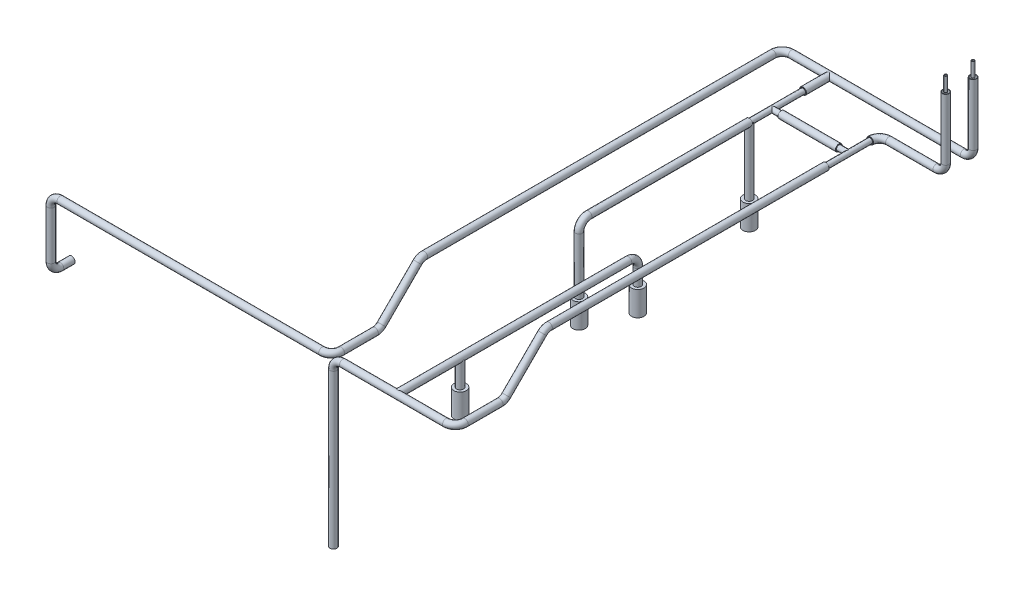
SolidWorks part; units mm, degrees
ref_plane "Alzado" through (0, 0, 0) normal (0, 0, 1) x (1, 0, 0)
ref_plane "Planta" through (0, 0, 0) normal (0, 1, 0) x (1, 0, 0)
ref_plane "Vista lateral" through (0, 0, 0) normal (1, 0, 0) x (0, 0, -1)
sketch3d "Croquis3D1"
  line L0 (-93.1567, 1334.4966, 5736.2426) -> (-93.1567, 1334.4966, 5856.2426)
  line L1 (-93.1567, 1434.4966, 5956.2426) -> (-93.1567, 1944.4966, 5956.2426)
  line L2 (6.8433, 2044.4966, 5956.2426) -> (2776.8433, 2044.4966, 5956.2426)
  line L3 (3566.8433, 2044.4966, 5956.2426) -> (3566.8433, 2044.4966, 5286.2426)
  line L4 (3566.8433, 2044.4966, 5286.2426) -> (3566.8433, 1774.4966, 5286.2426)
  line L5 (2876.8433, 2044.4966, 5856.2426) -> (2876.8433, 2044.4966, 5497.664)
  line L6 (2876.8433, 2073.7859, 5426.9533) -> (2876.8433, 2453.6135, 5047.1257)
  line L7 (2876.8433, 2482.9028, 4976.4151) -> (2876.8433, 2482.9028, 1287.8364)
  line L9 (3566.8433, 2044.4966, 5286.2426) -> (3566.8433, 2044.4966, 3506.2426)
  line L10 (3566.8433, 1944.4966, 3406.2426) -> (3566.8433, 1774.4966, 3406.2426)
  line L11 (2976.8433, 2482.9028, 1187.8364) -> (3376.8433, 2482.9028, 1187.8364)
  line L12 (3376.8433, 2482.9028, 1187.8364) -> (3376.8433, 2482.9028, 1797.8364)
  line L13 (3376.8433, 2482.9028, 1187.8364) -> (4796.8433, 2482.9028, 1187.8364)
  line L14 (4896.8433, 2582.9028, 1187.8364) -> (4896.8433, 3232.9028, 1187.8364)
  line L15 (3376.8433, 2482.9028, 1797.8364) -> (4186.8433, 2482.9028, 1797.8364)
  line L16 (4186.8433, 2482.9028, 1797.8364) -> (4186.8433, 2482.9028, 1567.8364)
  line L17 (4286.8433, 2482.9028, 1467.8364) -> (4786.8433, 2482.9028, 1467.8364)
  line L18 (4886.8433, 2582.9028, 1467.8364) -> (4886.8433, 3232.9028, 1467.8364)
  line L19 (4186.8433, 2482.9028, 1797.8364) -> (4186.8433, 2482.9028, 2037.8364)
  line L20 (4186.8433, 2482.9028, 2037.8364) -> (4186.8433, 2482.9028, 4966.4151)
  line L21 (4186.8433, 2453.6135, 5037.1257) -> (4186.8433, 2073.7859, 5416.9533)
  line L22 (4186.8433, 2044.4966, 5487.664) -> (4186.8433, 2044.4966, 5856.2426)
  line L23 (4086.8433, 2044.4966, 5956.2426) -> (3566.8433, 2044.4966, 5956.2426)
  line L24 (3376.8433, 2482.9028, 1797.8364) -> (3376.8433, 2482.9028, 2037.8364)
  line L25 (3376.8433, 2482.9028, 2037.8364) -> (3376.8433, 2482.9028, 3737.8364)
  line L26 (3376.8433, 2382.9028, 3837.8364) -> (3376.8433, 1782.9028, 3837.8364)
  line L27 (3376.8433, 2482.9028, 2037.8364) -> (3376.8433, 1782.9028, 2037.8364)
  line L28 (3566.8433, 1774.4966, 5286.2426) -> (3566.8433, 1514.4966, 5286.2426)
  line L29 (3566.8433, 1774.4966, 3406.2426) -> (3566.8433, 1514.4966, 3406.2426)
  line L30 (3376.8433, 1782.9028, 3837.8364) -> (3376.8433, 1522.9028, 3837.8364)
  line L31 (3376.8433, 1782.9028, 2037.8364) -> (3376.8433, 1522.9028, 2037.8364)
  line L32 (4886.8433, 3232.9028, 1467.8364) -> (4886.8433, 3382.9028, 1467.8364)
  line L33 (4896.8433, 3232.9028, 1187.8364) -> (4896.8433, 3382.9028, 1187.8364)
  line L34 (3566.8433, 2044.4966, 5956.2426) -> (2996.8433, 2044.4966, 5956.2426)
  line L35 (2896.8433, 1944.4966, 5956.2426) -> (2896.8433, 314.4966, 5956.2426)
  line L36 (3376.8433, 2482.9028, 3737.8364) -> (3376.8433, 2482.9028, 2037.8364) construction
  arc A0 (3376.8433, 2482.9028, 3737.8364) -> (3376.8433, 2382.9028, 3837.8364) centre (3376.8433, 2382.9028, 3737.8364) ccw
  arc A1 (4186.8433, 2482.9028, 4966.4151) -> (4186.8433, 2453.6135, 5037.1257) centre (4186.8433, 2382.9028, 4966.4151) ccw
  arc A2 (4186.8433, 2482.9028, 1567.8364) -> (4286.8433, 2482.9028, 1467.8364) centre (4286.8433, 2482.9028, 1567.8364) ccw
  arc A3 (4786.8433, 2482.9028, 1467.8364) -> (4886.8433, 2582.9028, 1467.8364) centre (4786.8433, 2582.9028, 1467.8364) ccw
  arc A4 (4796.8433, 2482.9028, 1187.8364) -> (4896.8433, 2582.9028, 1187.8364) centre (4796.8433, 2582.9028, 1187.8364) ccw
  arc A5 (2876.8433, 2482.9028, 1287.8364) -> (2976.8433, 2482.9028, 1187.8364) centre (2976.8433, 2482.9028, 1287.8364) ccw
  arc A6 (2876.8433, 2453.6135, 5047.1257) -> (2876.8433, 2482.9028, 4976.4151) centre (2876.8433, 2382.9028, 4976.4151) ccw
  arc A7 (2876.8433, 2044.4966, 5497.664) -> (2876.8433, 2073.7859, 5426.9533) centre (2876.8433, 2144.4966, 5497.664) ccw
  arc A8 (4186.8433, 2073.7859, 5416.9533) -> (4186.8433, 2044.4966, 5487.664) centre (4186.8433, 2144.4966, 5487.664) ccw
  arc A9 (4186.8433, 2044.4966, 5856.2426) -> (4086.8433, 2044.4966, 5956.2426) centre (4086.8433, 2044.4966, 5856.2426) ccw
  arc A10 (-93.1567, 1944.4966, 5956.2426) -> (6.8433, 2044.4966, 5956.2426) centre (6.8433, 1944.4966, 5956.2426) ccw
  arc A11 (-93.1567, 1334.4966, 5856.2426) -> (-93.1567, 1434.4966, 5956.2426) centre (-93.1567, 1434.4966, 5856.2426) ccw
  arc A12 (3566.8433, 2044.4966, 3506.2426) -> (3566.8433, 1944.4966, 3406.2426) centre (3566.8433, 1944.4966, 3506.2426) ccw
  arc A13 (2876.8433, 2044.4966, 5856.2426) -> (2776.8433, 2044.4966, 5956.2426) centre (2776.8433, 2044.4966, 5856.2426) ccw
  arc A14 (2896.8433, 1944.4966, 5956.2426) -> (2996.8433, 2044.4966, 5956.2426) centre (2996.8433, 1944.4966, 5956.2426) ccw
  point P34 (4186.8433, 2482.9028, 5007.8364)
  point P35 (4286.8433, 2382.9028, 4966.4151)
  point P38 (4186.8433, 2482.9028, 1467.8364)
  point P39 (4286.8433, 2382.9028, 1567.8364)
  point P42 (4886.8433, 2482.9028, 1467.8364)
  point P43 (4786.8433, 2582.9028, 1567.8364)
  point P46 (4896.8433, 2482.9028, 1187.8364)
  point P47 (4796.8433, 2582.9028, 1287.8364)
  point P50 (2876.8433, 2482.9028, 1187.8364)
  point P51 (2976.8433, 2382.9028, 1287.8364)
  point P54 (2876.8433, 2482.9028, 5017.8364)
  point P55 (2776.8433, 2382.9028, 4976.4151)
  point P58 (2876.8433, 2044.4966, 5456.2426)
  point P59 (2976.8433, 2144.4966, 5497.664)
  point P62 (4186.8433, 2044.4966, 5446.2426)
  point P63 (4086.8433, 2144.4966, 5487.664)
  point P66 (4186.8433, 2044.4966, 5956.2426)
  point P67 (4086.8433, 1944.4966, 5856.2426)
  point P70 (-93.1567, 2044.4966, 5956.2426)
  point P71 (6.8433, 1944.4966, 5856.2426)
  point P74 (-93.1567, 1334.4966, 5956.2426)
  point P75 (-193.1567, 1434.4966, 5856.2426)
  point P81 (3376.8433, 2482.9028, 3837.8364)
  point P82 (3476.8433, 2382.9028, 3737.8364)
  point P85 (3566.8433, 2044.4966, 3406.2426)
  point P86 (3466.8433, 1944.4966, 3506.2426)
  point P89 (2876.8433, 2044.4966, 5956.2426)
  point P91 (2776.8433, 1944.4966, 5856.2426)
  point P96 (2896.8433, 2044.4966, 5956.2426)
  point P97 (2996.8433, 1944.4966, 5856.2426)
  dimension "D31" = 100
  dimension "D38" = 100
  dimension "D11" = 100
  dimension "D41" = 100
  dimension "D1" = 220
  dimension "D2" = 710
  dimension "D3" = 3660
  dimension "D4" = 670
  dimension "D5" = 270
  dimension "D6" = 2970
  dimension "D7" = 500
  dimension "D8" = 45
  dimension "D9" = 620
  dimension "D10" = 3830
  dimension "D39" = 670
  dimension "D12" = 1880
  dimension "D13" = 270
  dimension "D14" = 500
  dimension "D15" = 610
  dimension "D16" = 1520
  dimension "D17" = 750
  dimension "D18" = 810
  dimension "D19" = 330
  dimension "D20" = 700
  dimension "D21" = 750
  dimension "D22" = 240
  dimension "D23" = 2970
  dimension "D24" = 45
  dimension "D25" = 620
  dimension "D26" = 510
  dimension "D27" = 240
  dimension "D28" = 1800
  dimension "D29" = 700
  dimension "D30" = 700
  dimension "D32" = 260
  dimension "D33" = 260
  dimension "D34" = 260
  dimension "D35" = 260
  dimension "D36" = 150
  dimension "D37" = 150
  dimension "D40" = 1730
ref_plane "Plano1" through (-93.1567, 1334.4966, 5736.2426) normal (0, 0, 1) x (1, 0, 0)
sketch "Croquis1" plane through (-93.1567, 1334.4966, 5736.2426) normal (0, 0, 1) x (1, 0, 0)
  circle A0 centre (0, 0) radius 36.5
  circle A1 centre (0, 0) radius 31.75
  dimension "D1" = 63.5
  dimension "D2" = 73
ref_plane "Plano3" through (4896.8433, 3232.9028, 1187.8364) normal (0, 1, 0) x (-1, 0, 0)
sketch "Croquis4" plane through (4896.8433, 3232.9028, 1187.8364) normal (0, 1, 0) x (-1, 0, 0)
  circle A0 centre (0, 0) radius 36.5
  circle A1 centre (0, 0) radius 31.75
  dimension "D1" = 73
  dimension "D2" = 63.5
ref_plane "Plano4" through (3566.8433, 1774.4966, 3406.2426) normal (0, -1, 0) x (1, 0, 0)
sketch "Croquis8" plane through (3566.8433, 1774.4966, 3406.2426) normal (0, -1, 0) x (1, 0, 0)
  circle A0 centre (0, 0) radius 36.5
  circle A1 centre (0, 0) radius 31.75
  dimension "D1" = 63.5
  dimension "D2" = 73
sketch3d "Croquis3D8"
  line L0 (3566.8433, 1774.4966, 3406.2426) -> (3566.8433, 1944.4966, 3406.2426)
  line L1 (3566.8433, 2044.4966, 3506.2426) -> (3566.8433, 2044.4966, 5956.2426)
  arc A0 (3566.8433, 1944.4966, 3406.2426) -> (3566.8433, 2044.4966, 3506.2426) centre (3566.8433, 1944.4966, 3506.2426) ccw
  point P5 (3666.8433, 1944.4966, 3506.2426)
ref_plane "Plano5" through (3376.8433, 1782.9028, 3837.8364) normal (0, -1, 0) x (1, 0, 0)
sketch "Croquis9" plane through (3376.8433, 1782.9028, 3837.8364) normal (0, -1, 0) x (1, 0, 0)
  circle A0 centre (0, 0) radius 36.5
  circle A1 centre (0, 0) radius 31.75
  dimension "D1" = 63.5
  dimension "D2" = 73
sketch3d "Croquis3D10"
  line L0 (3376.8433, 1782.9028, 3837.8364) -> (3376.8433, 2382.9028, 3837.8364)
  line L1 (3376.8433, 2482.9028, 3737.8364) -> (3376.8433, 2482.9028, 2037.8364)
  arc A0 (3376.8433, 2382.9028, 3837.8364) -> (3376.8433, 2482.9028, 3737.8364) centre (3376.8433, 2382.9028, 3737.8364) ccw
  point P5 (3276.8433, 2382.9028, 3737.8364)
sketch "Croquis12" plane through (3566.8433, 1774.4966, 3406.2426) normal (0, -1, 0) x (1, 0, 0)
  circle A0 centre (0, 0) radius 65.5
  dimension "D1" = 131
sketch "Croquis13" plane through (3376.8433, 1782.9028, 3837.8364) normal (0, -1, 0) x (1, 0, 0)
  circle A0 centre (0, 0) radius 65.5
  dimension "D1" = 131
ref_plane "Plano7" through (3566.8433, 1774.4966, 5286.2426) normal (0, -1, 0) x (1, 0, 0)
sketch "Croquis14" plane through (3566.8433, 1774.4966, 5286.2426) normal (0, -1, 0) x (1, 0, 0)
  circle A0 centre (0, 0) radius 36.5
  circle A1 centre (0, 0) radius 31.75
  dimension "D1" = 73
  dimension "D2" = 63.5
sketch3d "Croquis3D12"
  line L0 (3566.8433, 2044.4966, 5286.2426) -> (3566.8433, 1774.4966, 5286.2426)
sketch "Croquis15" plane through (3566.8433, 1774.4966, 5286.2426) normal (0, -1, 0) x (1, 0, 0)
  circle A0 centre (0, 0) radius 65.5
  dimension "D1" = 131
ref_plane "Plano8" through (3376.8433, 1782.9028, 2037.8364) normal (0, -1, 0) x (1, 0, 0)
sketch "Croquis16" plane through (3376.8433, 1782.9028, 2037.8364) normal (0, -1, 0) x (1, 0, 0)
  circle A0 centre (0, 0) radius 36.5
  circle A1 centre (0, 0) radius 31.75
  dimension "D1" = 63.5
  dimension "D2" = 73
sketch3d "Croquis3D13"
  line L0 (3376.8433, 2482.9028, 2037.8364) -> (3376.8433, 1782.9028, 2037.8364)
sketch "Croquis18" plane through (3376.8433, 1782.9028, 2037.8364) normal (0, -1, 0) x (1, 0, 0)
  circle A0 centre (0, 0) radius 65.5
  dimension "D1" = 131
sketch "Croquis19" plane through (4896.8433, 3232.9028, 1187.8364) normal (0, 1, 0) x (-1, 0, 0)
  circle A0 centre (0, 0) radius 15
  circle A1 centre (0, 0) radius 10.25
  dimension "D1" = 30
  dimension "D2" = 20.5
extrude "Saliente-Extruir5" add sketch "Croquis19" along normal blind 150 separate body
ref_plane "Plano9" through (4886.8433, 3232.9028, 1467.8364) normal (0, 1, 0) x (-1, 0, 0)
sketch "Croquis21" plane through (4886.8433, 3232.9028, 1467.8364) normal (0, 1, 0) x (-1, 0, 0)
  circle A0 centre (0, 0) radius 15
  circle A1 centre (0, 0) radius 10.25
  dimension "D1" = 30
  dimension "D2" = 20.5
extrude "Saliente-Extruir6" add sketch "Croquis21" along normal blind 150 separate body
sweep "Barrer1" add profiles "Croquis1" path "Croquis3D1"
sweep "Barrer2" add profiles "Croquis9" path "Croquis3D10"
sketch3d "Croquis3D15"
  line L0 (2896.8433, 314.4966, 5956.2426) -> (2896.8433, 1944.4966, 5956.2426)
  line L1 (2996.8433, 2044.4966, 5956.2426) -> (4086.8433, 2044.4966, 5956.2426)
  line L2 (4186.8433, 2044.4966, 5856.2426) -> (4186.8433, 2044.4966, 5487.664)
  line L3 (4186.8433, 2073.7859, 5416.9533) -> (4186.8433, 2453.6135, 5037.1257)
  line L4 (4186.8433, 2482.9028, 4966.4151) -> (4186.8433, 2482.9028, 2037.8364)
  arc A0 (2896.8433, 1944.4966, 5956.2426) -> (2996.8433, 2044.4966, 5956.2426) centre (2996.8433, 1944.4966, 5956.2426) ccw
  arc A1 (4086.8433, 2044.4966, 5956.2426) -> (4186.8433, 2044.4966, 5856.2426) centre (4086.8433, 2044.4966, 5856.2426) ccw
  arc A2 (4186.8433, 2044.4966, 5487.664) -> (4186.8433, 2073.7859, 5416.9533) centre (4186.8433, 2144.4966, 5487.664) ccw
  arc A3 (4186.8433, 2453.6135, 5037.1257) -> (4186.8433, 2482.9028, 4966.4151) centre (4186.8433, 2382.9028, 4966.4151) ccw
  point P5 (2996.8433, 1944.4966, 5856.2426)
  point P10 (4086.8433, 2144.4966, 5856.2426)
  point P16 (4286.8433, 2144.4966, 5487.664)
  point P22 (4086.8433, 2382.9028, 4966.4151)
ref_plane "Plano10" through (2896.8433, 314.4966, 5956.2426) normal (0, -1, 0) x (1, 0, 0)
sketch "Croquis23" plane through (2896.8433, 314.4966, 5956.2426) normal (0, -1, 0) x (1, 0, 0)
  circle A0 centre (0, 0) radius 36.5
  circle A1 centre (0, 0) radius 31.75
  dimension "D1" = 63.5
  dimension "D2" = 73
sweep "Barrer3" add profiles "Croquis23" path "Croquis3D15"
sketch3d "Croquis3D16"
  line L0 (3376.8433, 2482.9028, 1187.8364) -> (3376.8433, 2482.9028, 1467.8364)
  line L1 (3376.8433, 2482.9028, 1187.8364) -> (3376.8433, 2482.9028, 1797.8364) construction
  dimension "D1" = 280
ref_plane "Plano11" through (3376.8433, 2482.9028, 1467.8364) normal (0, 0, 1) x (1, 0, 0)
sketch "Croquis24" plane through (3376.8433, 2482.9028, 1467.8364) normal (0, 0, 1) x (1, 0, 0)
  circle A0 centre (0, 0) radius 36.5
  circle A1 centre (0, 0) radius 31.75
  dimension "D1" = 63.5
  dimension "D2" = 73
sweep "Barrer4" add profiles "Croquis24" path "Croquis3D16"
sketch3d "Croquis3D17"
  line L0 (3376.8433, 2482.9028, 1797.8364) -> (4186.8433, 2482.9028, 1797.8364) construction
  line L1 (3476.8433, 2482.9028, 1797.8364) -> (4086.8433, 2482.9028, 1797.8364)
  dimension "D1" = 610
  dimension "D2" = 100
ref_plane "Plano12" through (3476.8433, 2482.9028, 1797.8364) normal (1, 0, 0) x (0, 0, -1)
sketch "Croquis25" plane through (3476.8433, 2482.9028, 1797.8364) normal (1, 0, 0) x (0, 0, -1)
  circle A0 centre (0, 0) radius 36.5
  circle A1 centre (0, 0) radius 31.75
  dimension "D1" = 63.5
  dimension "D2" = 73
sweep "Barrer5" add profiles "Croquis25" path "Croquis3D17"
sketch "Croquis26" plane through (4886.8433, 3232.9028, 1467.8364) normal (0, 1, 0) x (-1, 0, 0)
  circle A0 centre (0, 0) radius 36.5
  circle A1 centre (0, 0) radius 31.75
  dimension "D1" = 63.5
  dimension "D2" = 73
sketch3d "Croquis3D18"
  line L0 (4886.8433, 3232.9028, 1467.8364) -> (4886.8433, 2582.9028, 1467.8364)
  line L1 (4786.8433, 2482.9028, 1467.8364) -> (4286.8433, 2482.9028, 1467.8364)
  arc A0 (4886.8433, 2582.9028, 1467.8364) -> (4786.8433, 2482.9028, 1467.8364) centre (4786.8433, 2582.9028, 1467.8364) ccw
  arc A1 (4286.8433, 2482.9028, 1467.8364) -> (4186.8433, 2482.9028, 1567.8364) centre (4286.8433, 2482.9028, 1567.8364) ccw
  point P5 (4786.8433, 2582.9028, 1367.8364)
  point P10 (4286.8433, 2582.9028, 1567.8364)
sweep "Barrer6" add profiles "Croquis26" path "Croquis3D18"
sweep "Barrer7" add profiles "Croquis8" path "Croquis3D8"
sweep "Barrer8" add profiles "Croquis16" path "Croquis3D13"
sweep "Barrer9" add profiles "Croquis14" path "Croquis3D12"
extrude "Saliente-Extruir7" add sketch "Croquis18" along normal up to vertex (260 mm away)
extrude "Saliente-Extruir8" add sketch "Croquis12" along normal up to vertex (260 mm away)
extrude "Saliente-Extruir9" add sketch "Croquis13" along normal up to vertex (260 mm away)
extrude "Saliente-Extruir10" add sketch "Croquis15" along normal up to vertex (260 mm away)
ref_plane "Plano13" through (3376.8433, 2482.9028, 2037.8364) normal (0, 0, 1) x (1, 0, 0)
sketch "Croquis27" plane through (3376.8433, 2482.9028, 2037.8364) normal (0, 0, 1) x (1, 0, 0)
  circle A0 centre (0, 0) radius 27
  circle A1 centre (0, 0) radius 24
  dimension "D1" = 54
  dimension "D2" = 48
extrude "Saliente-Extruir12" add sketch "Croquis27" against normal blind 569
ref_plane "Plano14" through (3376.8433, 2482.9028, 1797.8364) normal (1, 0, 0) x (0, 0, -1)
sketch "Croquis28" plane through (3376.8433, 2482.9028, 1797.8364) normal (1, 0, 0) x (0, 0, -1)
  circle A0 centre (0, 0) radius 27
  circle A1 centre (0, 0) radius 24
  dimension "D1" = 48
  dimension "D2" = 54
extrude "Saliente-Extruir13" add sketch "Croquis28" along normal blind 99
ref_plane "Plano15" through (4186.8433, 2482.9028, 2037.8364) normal (0, 0, 1) x (1, 0, 0)
sketch "Croquis29" plane through (4186.8433, 2482.9028, 2037.8364) normal (0, 0, 1) x (1, 0, 0)
  circle A0 centre (0, 0) radius 27
  circle A1 centre (0, 0) radius 24
  dimension "D1" = 48
  dimension "D2" = 54
extrude "Saliente-Extruir14" add sketch "Croquis29" against normal blind 469 separate body
ref_plane "Plano16" through (4186.8433, 2482.9028, 1797.8364) normal (1, 0, 0) x (0, 0, -1)
sketch "Croquis30" plane through (4186.8433, 2482.9028, 1797.8364) normal (1, 0, 0) x (0, 0, -1)
  circle A0 centre (0, 0) radius 27
  circle A1 centre (0, 0) radius 24
  dimension "D1" = 48
  dimension "D2" = 54
extrude "Saliente-Extruir15" add sketch "Croquis30" against normal blind 99 and the other way blind 5
